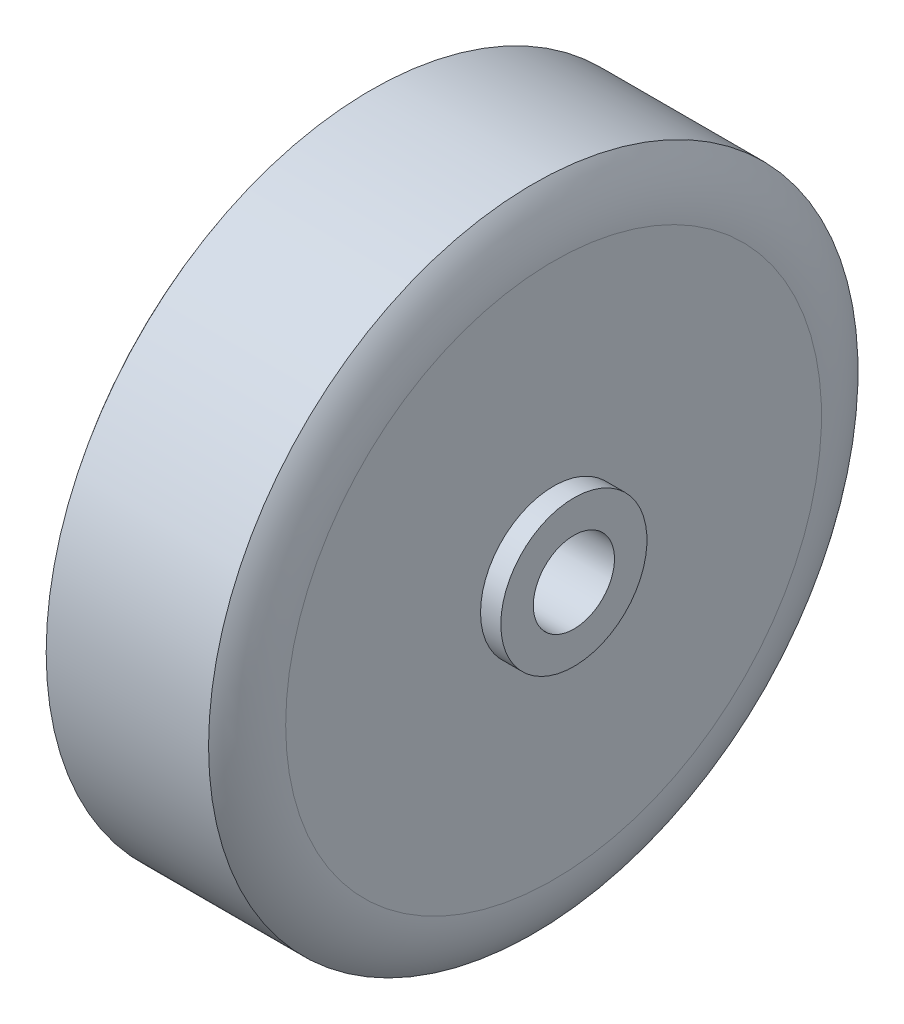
SolidWorks part; units mm, degrees
ref_plane "Plan de face" through (0, 0, 0) normal (0, 0, 1) x (1, 0, 0)
ref_plane "Plan de dessus" through (0, 0, 0) normal (0, 1, 0) x (1, 0, 0)
ref_plane "Plan de droite" through (0, 0, 0) normal (1, 0, 0) x (0, 0, -1)
sketch "Esquisse1" plane through (0, 0, 0) normal (0, 0, 1) x (1, 0, 0)
  line L0 (-30, 0) -> (30, 0) construction
  line L1 (0, 0) -> (0, 80) construction
  line L2 (30, 10) -> (-30, 10)
  line L3 (-30, 10) -> (-30, 18)
  line L4 (-30, 18) -> (-25, 18)
  line L5 (-25, 18) -> (-25, 66)
  line L6 (-20, 80) -> (20, 80)
  line L7 (25, 18) -> (25, 66)
  line L8 (30, 18) -> (25, 18)
  line L9 (30, 10) -> (30, 18)
  arc A0 (-25, 66) -> (-20, 80) centre (-2.9, 66) cw
  arc A1 (25, 66) -> (20, 80) centre (2.9, 66) ccw
  point P18 (0, 10)
  dimension "D1" = 20
  dimension "D2" = 60
  dimension "D3" = 40
  dimension "D4" = 160
  dimension "D5" = 14
  dimension "D6" = 50
  dimension "D7" = 8
revolve "Révolution1" add sketch "Esquisse1" angle 360 about L0
